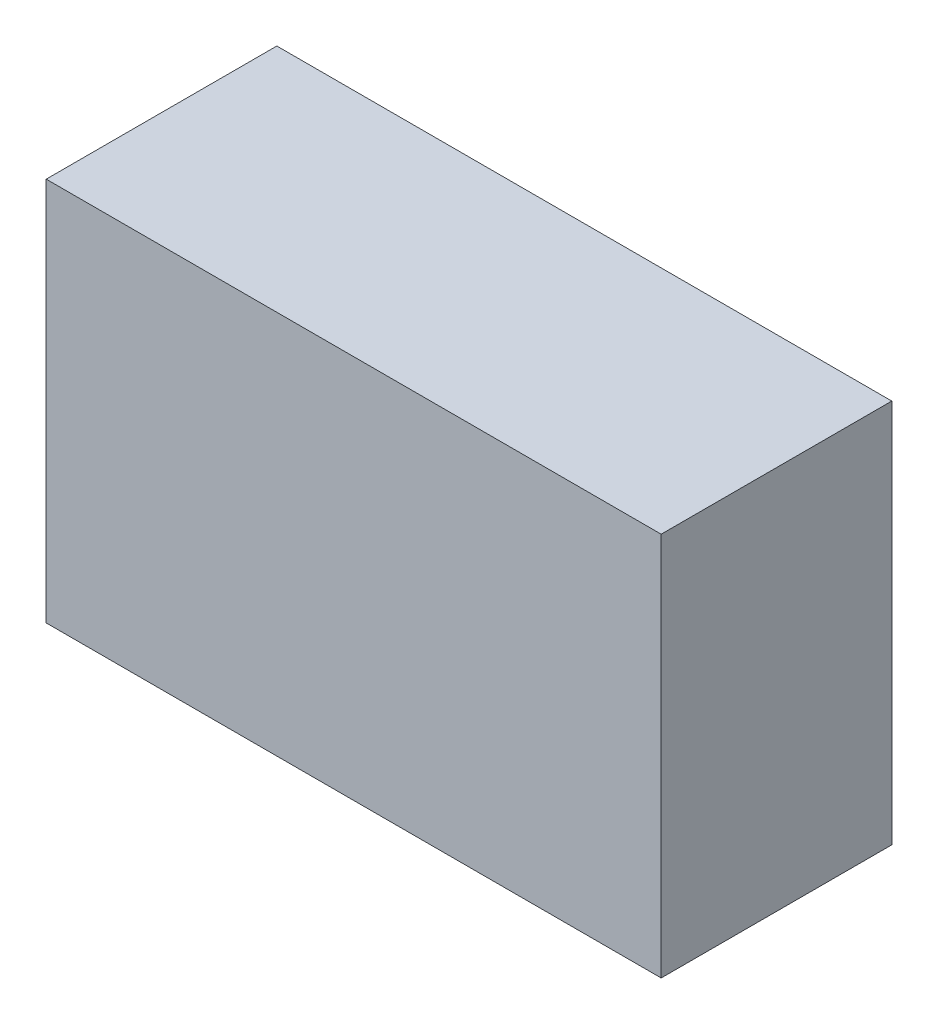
SolidWorks part; units mm, degrees
ref_plane "Płaszczyzna przednia" through (0, 0, 0) normal (0, 0, 1) x (1, 0, 0)
ref_plane "Płaszczyzna górna" through (0, 0, 0) normal (0, 1, 0) x (1, 0, 0)
ref_plane "Płaszczyzna prawa" through (0, 0, 0) normal (1, 0, 0) x (0, 0, -1)
sketch "Szkic1" plane through (0, 0, 0) normal (0, 0, 1) x (1, 0, 0)
  line L1 (0, 0) -> (80, 0)
  line L2 (0, 0) -> (0, 50)
  line L3 (0, 50) -> (80, 50)
  line L4 (80, 0) -> (80, 50)
  dimension "D1" = 50
  dimension "D2" = 80
extrude "Dodanie-wyciągnięcie1" add sketch "Szkic1" along normal blind 30
